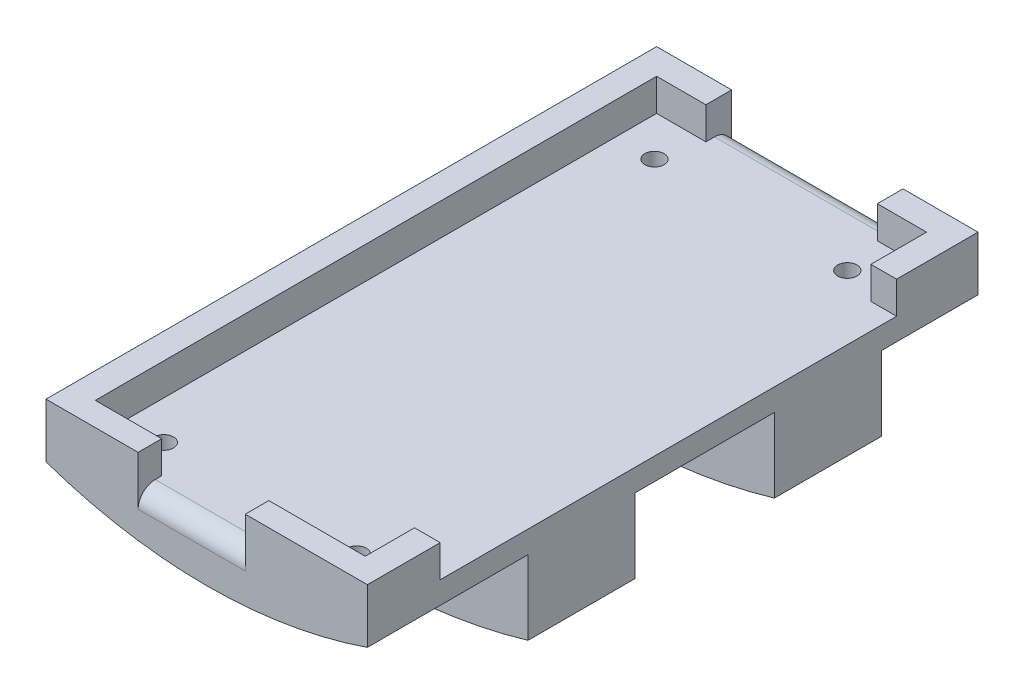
SolidWorks part; units mm, degrees
ref_plane "Front Plane" through (0, 0, 0) normal (0, 0, 1) x (1, 0, 0)
ref_plane "Top Plane" through (0, 0, 0) normal (0, 1, 0) x (1, 0, 0)
ref_plane "Right Plane" through (0, 0, 0) normal (1, 0, 0) x (0, 0, -1)
sketch "Sketch1" plane through (0, 0, 0) normal (0, 0, 1) x (1, 0, 0)
  circle A0 centre (0, 58.42) radius 58.42
  dimension "D1" = 116.84
extrude "Boss-Extrude1" add sketch "Sketch1" along normal blind 72.39
sketch "Sketch3" plane through (0, 0, 0) normal (0, 0, -1) x (-1, 0, 0)
  circle A0 centre (0, 58.42) radius 66.802
extrude "Boss-Extrude2" add sketch "Sketch3" against normal blind 12.7 from offset 40.64
sketch "Sketch5" plane through (0, 0, 0) normal (0, 0, -1) x (-1, 0, 0)
  circle A0 centre (0, 58.42) radius 66.802
  dimension "D1" = 133.604
extrude "Boss-Extrude3" add sketch "Sketch5" against normal blind 12.7 from offset 11.43
sketch "Sketch2" plane through (0, 0, 0) normal (0, 0, -1) x (-1, 0, 0)
  line L1 (19.05, -25.4) -> (69.85, -25.4)
  line L2 (19.05, -25.4) -> (19.05, 127)
  line L3 (19.05, 127) -> (69.85, 127)
  line L4 (69.85, -25.4) -> (69.85, 127)
  line L5 (-19.05, 127) -> (-69.85, 127)
  line L6 (-19.05, 127) -> (-19.05, -25.4)
  line L7 (-19.05, -25.4) -> (-69.85, -25.4)
  line L8 (-69.85, 127) -> (-69.85, -25.4)
  dimension "D1" = 152.4
  dimension "D2" = 50.8
  dimension "D3" = 19.05
  dimension "D4" = 25.4
  dimension "D5" = 19.05
  dimension "D6" = 50.8
  dimension "D7" = 152.4
  dimension "D8" = 25.4
extrude "Cut-Extrude1" cut sketch "Sketch2" against normal through all
sketch "Sketch7" plane through (0, 0, 0) normal (0, 0, -1) x (-1, 0, 0)
  line L0 (19.05, 3.1933) -> (19.05, 113.6467) construction
  line L1 (19.05, 9.6318) -> (-19.05, 9.6318)
  line L2 (19.05, 9.6318) -> (19.05, 123.9318)
  line L3 (19.05, 123.9318) -> (-19.05, 123.9318)
  line L4 (-19.05, 9.6318) -> (-19.05, 123.9318)
  line L5 (-19.05, 113.6467) -> (-19.05, 3.1933) construction
  dimension "D1" = 114.3
  dimension "D2" = 6.4386
extrude "Cut-Extrude3" cut sketch "Sketch7" against normal through all contours L2 L3 L4 L1
sketch "Sketch8" plane through (0, 0, 0) normal (0, 0, -1) x (-1, 0, 0)
  line L0 (19.05, 9.6318) -> (-19.05, 9.6318) construction
  line L1 (16.002, 9.6318) -> (-16.002, 9.6318)
  line L2 (16.002, 9.6318) -> (16.002, 5.8218)
  line L3 (16.002, 5.8218) -> (-16.002, 5.8218)
  line L4 (-16.002, 9.6318) -> (-16.002, 5.8218)
  dimension "D1" = 3.81
  dimension "D2" = 3.048
  dimension "D3" = 32.004
extrude "Cut-Extrude4" cut sketch "Sketch8" against normal blind 66.548 from offset 3.048
sketch "Sketch9" plane through (0, 0, 0) normal (0, 0, -1) x (-1, 0, 0)
  line L0 (19.05, 9.6318) -> (-19.05, 9.6318) construction
  line L1 (10.16, 9.6318) -> (-10.16, 9.6318)
  line L2 (10.16, 9.6318) -> (10.16, 5.8218)
  line L3 (10.16, 5.8218) -> (-10.16, 5.8218)
  line L4 (-10.16, 9.6318) -> (-10.16, 5.8218)
  dimension "D1" = 20.32
  dimension "D2" = 8.89
  dimension "D3" = 3.81
extrude "Cut-Extrude5" cut sketch "Sketch9" against normal blind 5.08
fillet "Fillet1" radius 2.032 1 edges at (0, 5.8218, 0)
sketch "Sketch10" plane through (16.002, 0, 0) normal (-1, 0, 0) x (0, 0, 1)
  line L0 (69.596, 9.6318) -> (3.048, 9.6318) construction
  line L1 (9.652, 9.6318) -> (63.754, 9.6318)
  line L2 (9.652, 9.6318) -> (9.652, 5.8218)
  line L3 (9.652, 5.8218) -> (63.754, 5.8218)
  line L4 (63.754, 9.6318) -> (63.754, 5.8218)
  line L5 (69.596, 5.8218) -> (3.048, 5.8218) construction
  dimension "D1" = 54.102
  dimension "D2" = 6.604
extrude "Cut-Extrude6" cut sketch "Sketch10" against normal through all
sketch "Sketch11" plane through (0, 0, 69.596) normal (0, 0, -1) x (-1, 0, 0)
  line L0 (16.002, 9.6318) -> (-16.002, 9.6318) construction
  line L1 (8.128, 9.6318) -> (-4.572, 9.6318)
  line L2 (8.128, 9.6318) -> (8.128, 5.8218)
  line L3 (8.128, 5.8218) -> (-4.572, 5.8218)
  line L4 (-4.572, 9.6318) -> (-4.572, 5.8218)
  line L5 (-16.002, 5.8218) -> (16.002, 5.8218) construction
  line L6 (16.002, 5.8218) -> (16.002, 9.6318) construction
  point P8 (8.128, 7.7268)
  dimension "D1" = 7.874
  dimension "D2" = 12.7
extrude "Cut-Extrude7" cut sketch "Sketch11" against normal through all
fillet "Fillet2" radius 2.032 1 edges at (-1.778, 5.8218, 72.39)
sketch "Sketch12" plane through (0, 5.8218, 0) normal (0, 1, 0) x (1, 0, 0)
  line L0 (4.572, -72.39) -> (19.05, -72.39) construction
  line L1 (-19.05, -72.39) -> (-8.128, -72.39) construction
  line L2 (-19.05, -72.39) -> (-19.05, 0) construction
  line L3 (19.05, -72.39) -> (19.05, -63.754) construction
  line L4 (-19.05, 0) -> (-10.16, 0) construction
  line L5 (10.16, 0) -> (19.05, 0) construction
  line L6 (19.05, -9.652) -> (19.05, 0) construction
  circle A0 centre (11.43, -66.04) radius 1.143
  circle A1 centre (-11.43, -66.04) radius 1.143
  circle A2 centre (11.43, -7.874) radius 1.143
  circle A3 centre (-11.43, -7.874) radius 1.143
  dimension "D3" = 2.286
  dimension "D4" = 2.286
  dimension "D9" = 2.286
  dimension "D11" = 2.286
  dimension "D1" = 6.35
  dimension "D2" = 6.35
  dimension "D5" = 7.62
  dimension "D6" = 7.62
  dimension "D7" = 7.874
  dimension "D8" = 7.62
  dimension "D10" = 7.874
  dimension "D12" = 7.62
extrude "Cut-Extrude8" cut sketch "Sketch12" against normal through all
sketch "Sketch13" plane through (0, 5.8218, 0) normal (0, 1, 0) x (1, 0, 0)
  line L0 (19.05, -9.652) -> (19.05, 0) construction
  line L1 (13.7764, -7.874) -> (12.6032, -5.842)
  line L2 (12.6032, -5.842) -> (10.2568, -5.842)
  line L3 (10.2568, -5.842) -> (9.0836, -7.874)
  line L4 (9.0836, -7.874) -> (10.2568, -9.906)
  line L5 (10.2568, -9.906) -> (12.6032, -9.906)
  line L6 (12.6032, -9.906) -> (13.7764, -7.874)
  line L7 (10.16, 0) -> (19.05, 0) construction
  line L8 (-19.05, -72.39) -> (-19.05, 0) construction
  line L9 (-9.0836, -7.874) -> (-10.2568, -5.842)
  line L10 (-10.2568, -5.842) -> (-12.6032, -5.842)
  line L11 (-12.6032, -5.842) -> (-13.7764, -7.874)
  line L12 (-13.7764, -7.874) -> (-12.6032, -9.906)
  line L13 (-12.6032, -9.906) -> (-10.2568, -9.906)
  line L14 (-10.2568, -9.906) -> (-9.0836, -7.874)
  line L15 (-19.05, -72.39) -> (-8.128, -72.39) construction
  line L16 (-9.0836, -66.04) -> (-10.2568, -64.008)
  line L17 (-10.2568, -64.008) -> (-12.6032, -64.008)
  line L18 (-12.6032, -64.008) -> (-13.7764, -66.04)
  line L19 (-13.7764, -66.04) -> (-12.6032, -68.072)
  line L20 (-12.6032, -68.072) -> (-10.2568, -68.072)
  line L21 (-10.2568, -68.072) -> (-9.0836, -66.04)
  line L23 (13.7764, -66.04) -> (12.6032, -64.008)
  line L24 (12.6032, -64.008) -> (10.2568, -64.008)
  line L25 (10.2568, -64.008) -> (9.0836, -66.04)
  line L26 (9.0836, -66.04) -> (10.2568, -68.072)
  line L27 (10.2568, -68.072) -> (12.6032, -68.072)
  line L28 (12.6032, -68.072) -> (13.7764, -66.04)
  circle A0 centre (11.43, -7.874) radius 2.032 construction
  circle A1 centre (-11.43, -7.874) radius 2.032 construction
  circle A2 centre (-11.43, -66.04) radius 2.032 construction
  circle A3 centre (11.43, -66.04) radius 2.032 construction
  dimension "D1" = 7.62
  dimension "D2" = 7.874
  dimension "D3" = 7.62
  dimension "D4" = 7.62
  dimension "D5" = 6.35
extrude "Cut-Extrude9" cut sketch "Sketch13" against normal up to next from offset 2.286
